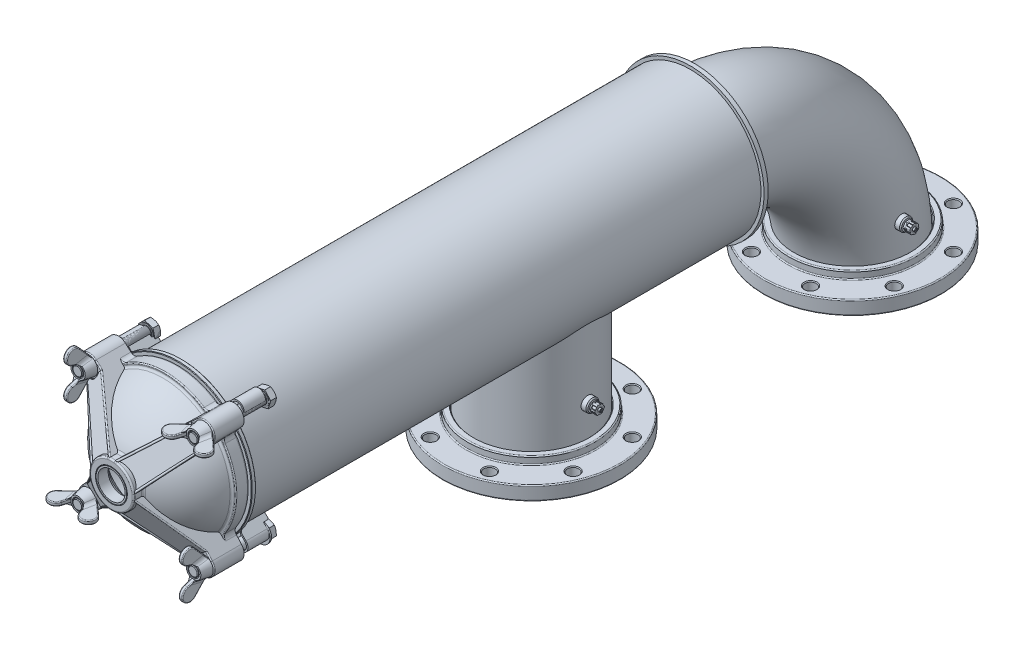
SolidWorks part; units mm, degrees
ref_plane "Front Plane" through (0, 0, 0) normal (0, 0, 1) x (1, 0, 0)
ref_plane "Top Plane" through (0, 0, 0) normal (0, 1, 0) x (1, 0, 0)
ref_plane "Right Plane" through (0, 0, 0) normal (1, 0, 0) x (0, 0, -1)
imported_body "DRB6-000261-1/DLB6.H080F.001-1/18U012-1-solid1"
imported_body "DRB6-000261-1/DLB6.H080F.001-1/14y217-1-solid1"
imported_body "DRB6-000261-1/DLB6.H080F.001-1/DAB6-000662-1-solid1"
imported_body "DRB6-000261-1/DLB6.H080F.001-1/DAB6-000662-2-solid1"
imported_body "DRB6-000261-1/DLB6.H080F.001-1/DAB6-000662-3-solid1"
imported_body "DRB6-000261-1/DLB6.H080F.001-1/DAB6-000662-4-solid1"
imported_body "DRB6-000261-1/DLB6.H080F.001-1/18U214-1-solid1"
imported_body "DRB6-000261-1/DLB6.H080F.001-1/18Y015-1-solid1"
imported_body "DRB6-000261-1/DLB6.H080F.001-1/18U218-1-solid1"
imported_body "DRB6-000261-1/DLB6.H080F.001-1/740102-000116-1-solid1"
imported_body "DRB6-000261-1/DLB6.H080F.001-1/740102-000116-2-solid1"
imported_body "DRB6-000261-1/DLB6.H080F.001-1/780104-000584-1-solid1"
imported_body "DRB6-000261-1/DLB6.H080F.001-1/780104-000584-2-solid1"
imported_body "DAB6-000679-1-solid1"
imported_body "770104-000089-1-solid1"
imported_body "DAB2-000591-1-solid1"
imported_body "DAB2-000591-2-solid1"
imported_body "780101-000937-1-solid1"
imported_body "DKB2-001305-1/DMA5-000547-1-solid1"
imported_body "DKB2-001305-2/DMA5-000547-1-solid1"
imported_body "760102-000076-1-solid1"
imported_body "760102-000076-2-solid1"
imported_body "760102-000076-3-solid1"
imported_body "760102-000076-4-solid1"
imported_body "760103-000070-2-solid1"
imported_body "760103-000070-3-solid1"
imported_body "760101-000297-2-solid1"
sketch "Sketch1" plane through (0, 0, 0) normal (1, 0, 0) x (0, 0, -1)
  line L0 (-1117.7, 39.1398) -> (-1117.7, 8.2508) construction
  line L1 (-1117.7, 39.1398) -> (-1224.9673, 39.1398)
  line L2 (-1117.7, 39.1398) -> (-1117.7, -35.4562)
  line L3 (-1117.7, -35.4562) -> (-1224.9673, -35.4562)
  line L4 (-1224.9673, 39.1398) -> (-1224.9673, -35.4562)
extrude "Cut-Extrude1" cut sketch "Sketch1" against normal through all and the other way through all
